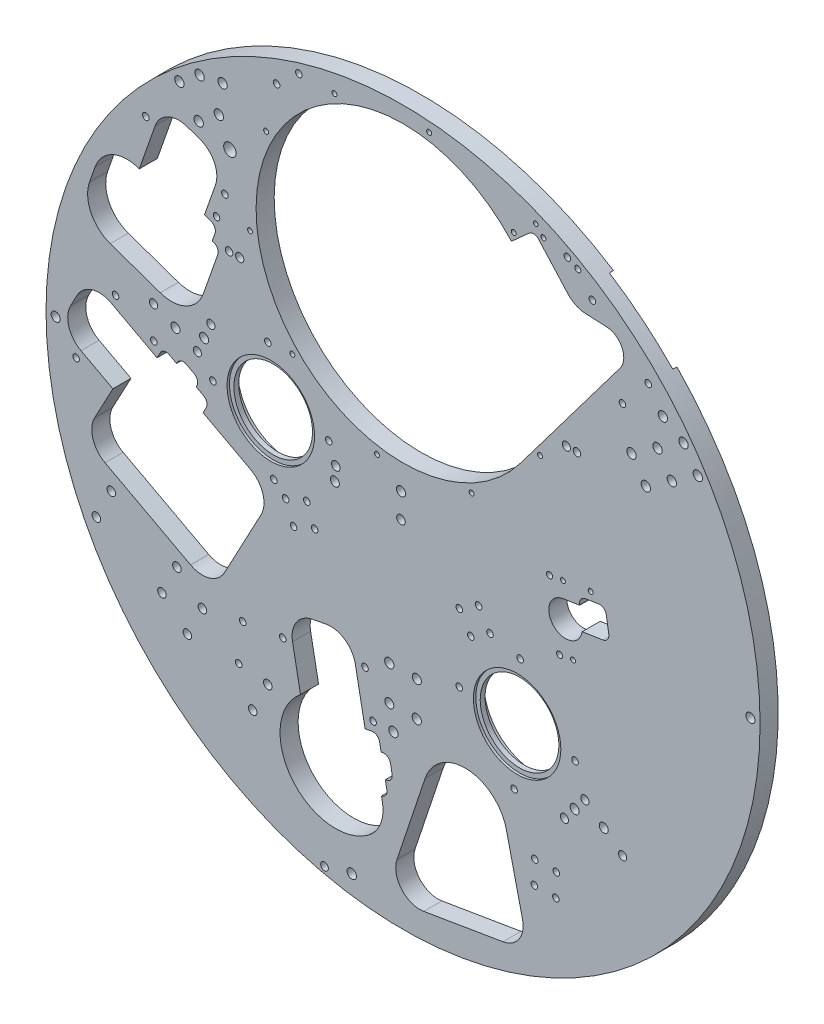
SolidWorks part; units mm, degrees
ref_plane "Front" through (0, 0, 0) normal (0, 0, 1) x (1, 0, 0)
ref_plane "Top" through (0, 0, 0) normal (0, 1, 0) x (1, 0, 0)
ref_plane "Right" through (0, 0, 0) normal (1, 0, 0) x (0, 0, -1)
sketch "Sketch1" plane through (0, 0, 0) normal (0, 0, 1) x (1, 0, 0)
  circle A0 centre (0, 0) radius 187.96
  dimension "D1" = 375.92
extrude ".375 base" add sketch "Sketch1" along normal blind 9.525
sketch "Sketch2" plane through (0, 0, 0) normal (0, 0, -1) x (-1, 0, 0)
  line L0 (0, 102.108) -> (2.8248, 24.7908) construction
  line L1 (-106.6865, 130.8873) -> (-100.7163, 123.4771) construction
  line L2 (-114.2842, 125.1577) -> (-61.7729, 55.5243)
  line L3 (-57.0751, 154.3418) -> (-68.2654, 142.1143)
  line L5 (-107.1075, 140.394) -> (-68.2654, 142.1143)
  arc A0 (-61.7729, 55.5243) -> (-57.0751, 154.3418) centre (0, 102.108) ccw
  arc A3 (-107.1075, 140.394) -> (-114.2842, 125.1577) centre (-106.6865, 130.8873) ccw
  point P3 (2.7877, 25.8061)
  point P13 (-101.3537, 124.2682)
  dimension "D1" = 1.016
  dimension "D3" = 135
  dimension "D4" = 77.3688
  dimension "D5" = 9.516
  dimension "D6" = 102.108
  dimension "D10" = 57.0751
  dimension "D2" = 1.016
  dimension "D7" = 106.6865
  dimension "D8" = 28.7793
  dimension "D9" = 168.8594
  dimension "D11" = 77.3172
  dimension "D12" = 5.3327
extrude "carosel" cut sketch "Sketch2" against normal through all
sketch "Sketch5" plane through (0, 0, 0) normal (0, 0, -1) x (-1, 0, 0)
  circle A0 centre (69.6168, 13.7234) radius 20.701
  circle A2 centre (-60.0464, -64.1854) radius 20.701
  dimension "D1" = 41.402
  dimension "D3" = 69.6168
  dimension "D4" = 13.7234
  dimension "D5" = 60.0464
  dimension "D6" = 64.1854
extrude "heater" cut sketch "Sketch5" against normal through all
sketch "Sketch8" plane through (0, 0, 0) normal (0, 0, -1) x (-1, 0, 0)
  circle A0 centre (69.6168, 13.7234) radius 27.0002
  circle A1 centre (69.6168, 13.7234) radius 20.701 construction
  circle A2 centre (-60.0464, -64.1854) radius 27.0002
  circle A3 centre (-60.0464, -64.1854) radius 20.701 construction
  dimension "D1" = 54.0004
extrude "heater seal" cut sketch "Sketch8" against normal blind 5.715
hole_wizard "#8-32 for heaters" positions "Sketch19" profile "Sketch18" tap size "#8-32" standard "Ansi Inch"
sketch "Sketch19" plane through (0, 0, 9.525) normal (0, 0, 1) x (1, 0, 0)
  line L0 (60.0464, -64.1854) -> (60.0464, -20.8608) construction
  line L2 (60.0464, -64.1854) -> (61.6444, -33.6944) construction
  circle A10 centre (60.0464, -64.1854) radius 27.0002 construction
  point P0 (-100.1078, 12.1254)
  point P1 (-68.0188, -16.7676)
  point P2 (-71.2148, 44.2144)
  point P3 (-39.1258, 15.3214)
  point P10 (29.5554, -62.5874)
  point P11 (58.4485, -94.6764)
  point P14 (90.5374, -65.7834)
  point P15 (61.6444, -33.6944)
  dimension "D1" = 39.1258
  dimension "D2" = 15.3214
  dimension "D3" = 44.2144
  dimension "D4" = 71.2148
  dimension "D5" = 100.1078
  dimension "D6" = 12.1254
  dimension "D7" = 16.7676
  dimension "D8" = 68.0188
  dimension "D9" = 3
  dimension "D10" = 30.5329
  dimension "D11" = 30.491
  dimension "D12" = 1.598
  dimension "D13" = 30.491
  dimension "D14" = 1.598
  dimension "D15" = 30.491
  dimension "D16" = 1.598
sketch "Sketch18" plane through (-100.1078, 12.1254, 9.525) normal (1, 0, 0) x (0, -1, 0)
  line L0 (0, 0) -> (0, 9.525)
  line L1 (0, 9.525) -> (1.7272, 9.525)
  line L2 (1.7272, 9.525) -> (1.7272, 0)
  line L5 (1.7272, 0) -> (0, 0)
  line L11 (0, -6.35) -> (0, 107.95) construction
  dimension "Thru Tap Drill Dia." = 3.4544
  dimension "Thru Tap Drill Depth" = 9.525
sketch "Sketch9" plane through (0, 0, 9.525) normal (0, 0, 1) x (1, 0, 0)
  circle A0 centre (-69.6168, 13.7234) radius 23.0251
  circle A1 centre (-69.6168, 13.7234) radius 20.701 construction
  circle A2 centre (60.0464, -64.1854) radius 23.0251
  circle A3 centre (60.0464, -64.1854) radius 20.701 construction
  dimension "D1" = 46.0502
extrude "Sample heater bore" cut sketch "Sketch9" against normal blind 1.27
hole_wizard "3/16 for clamps" positions "Sketch15" profile "Sketch14" hole size "3/16" standard "Ansi Inch"
sketch "Sketch15" plane through (0, 0, 9.525) normal (0, 0, 1) x (1, 0, 0)
  point P0 (-104.7245, 29.3544)
  point P1 (-119.8109, 26.5067)
  point P6 (90.3338, -87.8485)
  point P7 (105.6609, -88.7352)
  dimension "D1" = 104.7245
  dimension "D2" = 29.3544
  dimension "D3" = 26.5067
  dimension "D4" = 119.8109
  dimension "D5" = 90.3338
  dimension "D6" = 105.6609
  dimension "D7" = 88.7352
  dimension "D8" = 87.8485
sketch "Sketch14" plane through (-104.7245, 29.3544, 9.525) normal (1, 0, 0) x (0, -1, 0)
  line L0 (0, 0) -> (0, 9.525)
  line L1 (0, 9.525) -> (2.3749, 9.525)
  line L2 (2.3749, 9.525) -> (2.3749, 0)
  line L5 (2.3749, 0) -> (0, 0)
  line L11 (0, -6.35) -> (0, 107.95) construction
  dimension "Thru Hole Dia." = 4.7498
  dimension "Thru Hole Depth" = 9.525
hole_wizard "#18 for clamps" positions "Sketch17" profile "Sketch16" hole size "#18" standard "Ansi Inch"
sketch "Sketch17" plane through (0, 0, 9.525) normal (0, 0, 1) x (1, 0, 0)
  point P0 (-101.1706, 37.3366)
  point P1 (-131.3433, 31.6413)
  point P2 (-108.2784, 21.3722)
  point P9 (84.9544, -94.7338)
  point P10 (95.7132, -80.9632)
  point P11 (115.6086, -96.5072)
  dimension "D1" = 101.1706
  dimension "D2" = 108.2784
  dimension "D3" = 131.3433
  dimension "D4" = 37.3366
  dimension "D5" = 21.3722
  dimension "D6" = 31.6413
  dimension "D7" = 84.9544
  dimension "D8" = 95.7132
  dimension "D9" = 115.6086
  dimension "D10" = 80.9632
  dimension "D11" = 94.7338
  dimension "D12" = 96.5072
sketch "Sketch16" plane through (-101.1706, 37.3366, 9.525) normal (1, 0, 0) x (0, -1, 0)
  line L0 (0, 0) -> (0, 9.525)
  line L1 (0, 9.525) -> (2.1526, 9.525)
  line L2 (2.1526, 9.525) -> (2.1526, 0)
  line L5 (2.1526, 0) -> (0, 0)
  line L11 (0, -6.35) -> (0, 107.95) construction
  dimension "Thru Hole Dia." = 4.3053
  dimension "Thru Hole Depth" = 9.525
sketch "Sketch20" plane through (0, 0, 0) normal (0, 0, -1) x (-1, 0, 0)
  circle A0 centre (182.88, 0) radius 2.3749
  circle A2 centre (-182.88, 0) radius 2.3749
  dimension "D1" = 4.7498
  dimension "D5" = 4.7498
  dimension "D4" = 182.88
  dimension "D6" = 182.88
extrude "locating pins - fabrication" cut sketch "Sketch20" against normal through all
sketch "Sketch29" plane through (0, 0, 0) normal (0, 0, -1) x (-1, 0, 0)
  line L0 (-75.6506, 127.7436) -> (-54.1018, 151.676)
  line L1 (-54.1018, 151.676) -> (-68.9675, 165.0611)
  line L2 (-68.9675, 165.0611) -> (-90.5163, 141.1288)
  line L3 (-75.6506, 127.7436) -> (-90.5163, 141.1288)
  line L5 (0, 0) -> (0, 172.265) construction
  line L6 (-68.2654, 142.1143) -> (-107.1075, 140.394) construction
  dimension "D1" = 32.2042
  dimension "D2" = 151.676
  dimension "D3" = 20.0038
  dimension "D4" = 54.1018
extrude "carousel hall sensor" cut sketch "Sketch29" against normal through all
fillet "Fillet3" radius 3.556 1 edges at (68.9675, 165.0611, 4.7625)
hole_wizard "#5-40 Tapped Hole1" positions "Sketch31" profile "Sketch30" tap size "#5-40" standard "Ansi Inch"
sketch "Sketch31" plane through (0, 0, 0) normal (0, 0, -1) x (-1, 0, 0)
  point P0 (-73.8764, 164.3542)
  dimension "D1" = 164.3542
  dimension "D2" = 73.8764
sketch "Sketch30" plane through (73.8764, 164.3542, 0) normal (1, 0, 0) x (0, 1, 0)
  line L0 (0, 0) -> (0, 9.525)
  line L1 (0, 9.525) -> (1.289, 9.525)
  line L2 (1.289, 9.525) -> (1.289, 0)
  line L5 (1.289, 0) -> (0, 0)
  line L11 (0, -6.35) -> (0, 107.95) construction
  dimension "Thru Tap Drill Dia." = 2.5781
  dimension "Thru Tap Drill Depth" = 9.525
hole_wizard "3/32 (0.093750) Diameter Hole1" positions "Sketch33" profile "Sketch32" hole size "3/32" standard "Ansi Inch"
sketch "Sketch33" plane through (0, 0, 0) normal (0, 0, -1) x (-1, 0, 0)
  point P0 (-69.8824, 168.7901)
  dimension "D1" = 69.8824
  dimension "D2" = 168.7901
sketch "Sketch32" plane through (69.8824, 168.7901, 0) normal (1, 0, 0) x (0, 1, 0)
  line L0 (0, 0) -> (0, 9.525)
  line L1 (0, 9.525) -> (1.1913, 9.525)
  line L2 (1.1913, 9.525) -> (1.1913, 0)
  line L5 (1.1913, 0) -> (0, 0)
  line L11 (0, -6.35) -> (0, 107.95) construction
  dimension "Thru Hole Dia." = 2.3825
  dimension "Thru Hole Depth" = 9.525
hole_wizard "#5-40 Tapped Hole2" positions "Sketch39" profile "Sketch38" tap size "#5-40" standard "Ansi Inch"
sketch "Sketch39" plane through (0, 0, 9.525) normal (0, 0, 1) x (1, 0, 0)
  point P0 (36.0788, 29.108)
  point P3 (58.2781, 158.9793)
  point P4 (13.7199, 182.3728)
  point P5 (-36.0788, 175.108)
  point P8 (-13.7199, 21.8432)
  point P9 (-72.0967, 139.9596)
  point P10 (-80.5761, 90.3532)
  point P11 (-58.2781, 45.2367)
  point P12 (72.0967, 64.2564)
  dimension "D1" = 13.7199
  dimension "D2" = 58.2781
  dimension "D3" = 36.0788
  dimension "D4" = 72.0967
  dimension "D5" = 80.5761
  dimension "D6" = 72.0967
  dimension "D7" = 36.0788
  dimension "D8" = 13.7199
  dimension "D9" = 58.2781
  dimension "D10" = 158.9793
  dimension "D11" = 182.3728
  dimension "D12" = 64.2564
  dimension "D13" = 29.108
  dimension "D14" = 21.8432
  dimension "D15" = 45.2367
  dimension "D16" = 90.3532
  dimension "D17" = 139.9596
  dimension "D18" = 175.108
sketch "Sketch38" plane through (36.0788, 29.108, 9.525) normal (1, 0, 0) x (0, -1, 0)
  line L0 (0, 0) -> (0, 9.525)
  line L1 (0, 9.525) -> (1.289, 9.525)
  line L2 (1.289, 9.525) -> (1.289, 0)
  line L5 (1.289, 0) -> (0, 0)
  line L11 (0, -6.35) -> (0, 107.95) construction
  dimension "Thru Tap Drill Dia." = 2.5781
  dimension "Thru Tap Drill Depth" = 9.525
fillet "Fillet6" radius 13.208 1 edges at (90.5163, 141.1288, 4.7625)
sketch "Sketch41" plane through (0, 0, 0) normal (0, 0, -1) x (-1, 0, 0)
  line L0 (-106.6865, 130.8873) -> (-109.7316, 103.0754) construction
  circle A0 centre (-106.6865, 130.8873) radius 27.9781
  point P4 (-109.7274, 103.1133)
  dimension "D2" = 55.9562
  dimension "D5" = 130.8873
  dimension "D1" = 0.0381
  dimension "D3" = 106.6865
  dimension "D4" = 27.8119
extrude "carousel drive" cut sketch "Sketch41" against normal blind 2.159
hole_wizard "#8-32 Tapped Hole2" positions "Sketch43" profile "Sketch42" tap size "#8-32" standard "Ansi Inch"
sketch "Sketch43" plane through (0, 0, 2.159) normal (0, 0, -1) x (-1, 0, 0)
  point P0 (-99.6461, 148.7604)
  point P9 (-129.0854, 125.5098)
  point P10 (-115.5017, 109.6054)
  dimension "D1" = 148.7604
  dimension "D2" = 125.5098
  dimension "D3" = 109.6054
  dimension "D4" = 115.5017
  dimension "D5" = 129.0854
  dimension "D6" = 99.6461
sketch "Sketch42" plane through (99.6461, 148.7604, 2.159) normal (1, 0, 0) x (0, 1, 0)
  line L0 (0, 0) -> (0, 7.366)
  line L1 (0, 7.366) -> (1.7272, 7.366)
  line L2 (1.7272, 7.366) -> (1.7272, 0)
  line L5 (1.7272, 0) -> (0, 0)
  line L11 (0, -6.35) -> (0, 107.95) construction
  dimension "Thru Tap Drill Dia." = 3.4544
  dimension "Thru Tap Drill Depth" = 7.366
hole_wizard "1/8 (0.125000) Diameter Hole1" positions "Sketch45" profile "Sketch44" hole size "1/8" standard "Ansi Inch"
sketch "Sketch45" plane through (0, 0, 0) normal (0, 0, -1) x (-1, 0, 0)
  point P0 (-91.9924, 159.1779)
  dimension "D1" = 91.9924
  dimension "D2" = 159.1779
sketch "Sketch44" plane through (91.9924, 159.1779, 0) normal (1, 0, 0) x (0, 1, 0)
  line L0 (0, 0) -> (0, 9.525)
  line L1 (0, 9.525) -> (1.5837, 9.525)
  line L2 (1.5837, 9.525) -> (1.5837, 0)
  line L5 (1.5837, 0) -> (0, 0)
  line L11 (0, -6.35) -> (0, 107.95) construction
  dimension "Thru Hole Dia." = 3.1674
  dimension "Thru Hole Depth" = 9.525
hole_wizard "#8-32 Tapped Hole3" positions "Sketch47" profile "Sketch46" tap size "#8-32" standard "Ansi Inch"
sketch "Sketch47" plane through (0, 0, 0) normal (0, 0, -1) x (-1, 0, 0)
  point P0 (-86.4987, 161.8352)
  dimension "D1" = 86.4987
  dimension "D2" = 161.8352
sketch "Sketch46" plane through (86.4987, 161.8352, 0) normal (1, 0, 0) x (0, 1, 0)
  line L0 (0, 0) -> (0, 9.525)
  line L1 (0, 9.525) -> (1.7272, 9.525)
  line L2 (1.7272, 9.525) -> (1.7272, 0)
  line L5 (1.7272, 0) -> (0, 0)
  line L11 (0, -6.35) -> (0, 107.95) construction
  dimension "Thru Tap Drill Dia." = 3.4544
  dimension "Thru Tap Drill Depth" = 9.525
hole_wizard "collection rotary valve - TOP" positions "Sketch49" profile "Sketch48" tap size "#8-32" standard "Ansi Inch"
sketch "Sketch49" plane through (0, 0, 9.525) normal (0, 0, 1) x (1, 0, 0)
  point P0 (-86.5559, -109.9422)
  point P1 (-84.4318, -89.7335)
  dimension "D1" = 84.4318
  dimension "D2" = 86.5559
  dimension "D3" = 109.9422
  dimension "D4" = 89.7335
sketch "Sketch48" plane through (-86.5559, -109.9422, 9.525) normal (1, 0, 0) x (0, -1, 0)
  line L0 (0, 0) -> (0, 9.525)
  line L1 (0, 9.525) -> (1.7272, 9.525)
  line L2 (1.7272, 9.525) -> (1.7272, 0)
  line L5 (1.7272, 0) -> (0, 0)
  line L11 (0, -6.35) -> (0, 107.95) construction
  dimension "Thru Tap Drill Dia." = 3.4544
  dimension "Thru Tap Drill Depth" = 9.525
sketch "Sketch50" plane through (0, 0, 0) normal (0, 0, -1) x (-1, 0, 0)
  line L0 (106.8708, 118.8518) -> (113.7025, 121.2459)
  line L2 (130.5354, 113.1494) -> (138.8718, 89.3618)
  line L3 (98.7743, 102.0188) -> (104.5287, 85.5989)
  line L4 (104.5287, 85.5989) -> (101.1728, 84.4228)
  line L5 (98.993, 79.8909) -> (100.421, 75.8159)
  line L6 (100.421, 75.8159) -> (99.7019, 75.5639)
  line L7 (97.5221, 71.0319) -> (105.1245, 49.3385)
  line L8 (0, 0) -> (0, 132.8162) construction
  line L9 (165.0511, 70.3397) -> (162.1309, 78.6727)
  line L10 (139.4711, 89.5718) -> (138.8718, 89.3618)
  line L24 (127.7843, 38.4393) -> (154.152, 47.6799)
  arc A0 (154.152, 47.6799) -> (165.0511, 70.3397) centre (148.2717, 64.4593) ccw
  arc A1 (127.7843, 38.4393) -> (105.1245, 49.3385) centre (121.904, 55.2188) cw
  arc A2 (130.5354, 113.1494) -> (113.7025, 121.2459) centre (118.0707, 108.7812) ccw
  arc A3 (106.8708, 118.8518) -> (98.7743, 102.0188) centre (111.2391, 106.387) ccw
  arc A4 (98.993, 79.8909) -> (101.1728, 84.4228) centre (102.3488, 81.0669) cw
  arc A5 (162.1309, 78.6727) -> (139.4711, 89.5718) centre (145.3514, 72.7923) ccw
  arc A6 (97.5221, 71.0319) -> (99.7019, 75.5639) centre (100.878, 72.208) cw
  circle A10 centre (0, 0) radius 187.96 construction
  dimension "D2" = 13.208
  dimension "D3" = 3.556
  dimension "D12" = 13.208
  dimension "D14" = 82.804
  dimension "D15" = 7.874
  dimension "D13" = 30.607
  dimension "D9" = 17.78
  dimension "D11" = 3.556
  dimension "D7" = 7.62
  dimension "D6" = 33.655
  dimension "D4" = 121.904
  dimension "D5" = 55.2188
  dimension "D8" = 7.112
  dimension "D10" = 11.43
  dimension "D16" = 63.5
  dimension "D17" = 19.313
extrude "Internal Sampler" cut sketch "Sketch50" against normal through all
hole_wizard "#8-32 Tapped Hole (Syringes)" positions "Sketch52" profile "Sketch51" tap size "#8-32" standard "Ansi Inch"
sketch "Sketch52" plane through (0, 0, 0) normal (0, 0, -1) x (-1, 0, 0)
  point P0 (151.3542, 25.516)
  point P1 (131.1888, 14.7486)
  point P2 (63.3203, -86.6623)
  point P3 (93.8184, 100.4166)
  point P4 (135.4074, 114.9914)
  point P5 (15.7468, -100.8545)
  point P6 (20.0328, -78.3999)
  point P7 (172.1113, -13.3585)
  point P19 (98.1866, 87.9518)
  dimension "D1" = 114.9914
  dimension "D2" = 100.4166
  dimension "D3" = 87.9518
  dimension "D4" = 25.516
  dimension "D5" = 14.7486
  dimension "D6" = 13.3585
  dimension "D7" = 172.1113
  dimension "D8" = 131.1888
  dimension "D9" = 151.3542
  dimension "D10" = 98.1866
  dimension "D11" = 93.8184
  dimension "D12" = 135.4074
  dimension "D13" = 78.3999
  dimension "D14" = 100.8545
  dimension "D15" = 86.6623
  dimension "D16" = 20.0328
  dimension "D17" = 15.7468
  dimension "D18" = 63.3203
sketch "Sketch51" plane through (-151.3542, 25.516, 0) normal (1, 0, 0) x (0, 1, 0)
  line L0 (0, 0) -> (0, 9.525)
  line L1 (0, 9.525) -> (1.7272, 9.525)
  line L2 (1.7272, 9.525) -> (1.7272, 0)
  line L5 (1.7272, 0) -> (0, 0)
  line L11 (0, -6.35) -> (0, 107.95) construction
  dimension "Thru Tap Drill Dia." = 3.4544
  dimension "Thru Tap Drill Depth" = 9.525
hole_wizard "#5 C'bore valve mounting" positions "Sketch54" profile "Sketch53" counterbore size "#5" standard "Ansi Inch"
sketch "Sketch54" plane through (0, 0, 0) normal (0, 0, -1) x (-1, 0, 0)
  point P0 (61.7947, -22.4206)
  point P1 (50.6874, -18.0453)
  point P6 (57.6358, -32.9787)
  point P9 (46.5284, -28.6034)
  point P12 (-35.6446, -36.3983)
  point P13 (-29.6312, -26.7749)
  point P14 (-39.7552, -20.4487)
  point P15 (-45.7686, -30.0721)
  point P24 (-80.6667, -121.4168)
  point P25 (-69.3207, -121.2188)
  point P26 (-80.4584, -133.353)
  point P27 (-69.1124, -133.155)
  dimension "D1" = 29.6312
  dimension "D2" = 39.7552
  dimension "D3" = 35.6446
  dimension "D4" = 45.7686
  dimension "D5" = 26.7749
  dimension "D6" = 20.4487
  dimension "D7" = 30.0721
  dimension "D8" = 36.3983
  dimension "D9" = 18.0453
  dimension "D10" = 22.4206
  dimension "D11" = 28.6034
  dimension "D12" = 32.9787
  dimension "D13" = 50.6874
  dimension "D14" = 61.7947
  dimension "D15" = 46.5284
  dimension "D16" = 57.6358
  dimension "D17" = 121.2188
  dimension "D18" = 121.4168
  dimension "D19" = 133.353
  dimension "D20" = 133.155
  dimension "D21" = 69.3207
  dimension "D22" = 69.1124
  dimension "D23" = 80.4584
  dimension "D24" = 80.6667
sketch "Sketch53" plane through (-61.7947, -22.4206, 0) normal (1, 0, 0) x (0, 1, 0)
  line L0 (0, 0) -> (0, 9.525)
  line L1 (0, 9.525) -> (1.7272, 9.525)
  line L3 (1.7272, 9.525) -> (1.7272, 5.08)
  line L4 (1.7272, 5.08) -> (3.175, 5.08)
  line L5 (3.175, 5.08) -> (3.175, 0)
  line L7 (3.175, 0) -> (0, 0)
  line L11 (0, -6.35) -> (0, 107.95) construction
  dimension "Thru Hole Dia." = 3.4544
  dimension "Thru Hole Depth" = 9.525
  dimension "C'Bore Dia." = 6.35
  dimension "C'Bore Depth" = 5.08
hole_wizard "3/16 (0.187500) Diameter Hole2" positions "Sketch56" profile "Sketch55" hole size "3/16" standard "Ansi Inch"
sketch "Sketch56" plane through (0, 0, 9.525) normal (0, 0, 1) x (1, 0, 0)
  point P0 (-7.239, -88.392)
  point P1 (7.239, -70.104)
  dimension "D1" = 70.104
  dimension "D2" = 88.392
  dimension "D3" = 7.239
  dimension "D4" = 7.239
sketch "Sketch55" plane through (-7.239, -88.392, 9.525) normal (1, 0, 0) x (0, -1, 0)
  line L0 (0, 0) -> (0, 9.525)
  line L1 (0, 9.525) -> (2.3749, 9.525)
  line L2 (2.3749, 9.525) -> (2.3749, 0)
  line L5 (2.3749, 0) -> (0, 0)
  line L11 (0, -6.35) -> (0, 107.95) construction
  dimension "Thru Hole Dia." = 4.7498
  dimension "Thru Hole Depth" = 9.525
hole_wizard "#10 (0.193500) Diameter Hole2" positions "Sketch58" profile "Sketch57" hole size "#10" standard "Ansi Inch"
sketch "Sketch58" plane through (0, 0, 9.525) normal (0, 0, 1) x (1, 0, 0)
  point P0 (7.239, -88.392)
  point P1 (-7.239, -70.104)
  dimension "D1" = 7.239
  dimension "D2" = 7.239
  dimension "D3" = 70.104
  dimension "D4" = 88.392
sketch "Sketch57" plane through (7.239, -88.392, 9.525) normal (1, 0, 0) x (0, -1, 0)
  line L0 (0, 0) -> (0, 9.525)
  line L1 (0, 9.525) -> (2.4574, 9.525)
  line L2 (2.4574, 9.525) -> (2.4574, 0)
  line L5 (2.4574, 0) -> (0, 0)
  line L11 (0, -6.35) -> (0, 107.95) construction
  dimension "Thru Hole Dia." = 4.9149
  dimension "Thru Hole Depth" = 9.525
hole_wizard "CBORE for #8 Socket Head Cap Screw1" positions "Sketch60" profile "Sketch59" counterbore size "#8" standard "Ansi Inch"
sketch "Sketch60" plane through (0, 0, 0) normal (0, 0, -1) x (-1, 0, 0)
  point P0 (35.3733, 5.7574)
  point P1 (1.0833, -1.634)
  dimension "D1" = 1.0833
  dimension "D2" = 35.3733
  dimension "D3" = 5.7574
  dimension "D4" = 1.634
sketch "Sketch59" plane through (-35.3733, 5.7574, 0) normal (1, 0, 0) x (0, 1, 0)
  line L0 (0, 0) -> (0, 9.525)
  line L1 (0, 9.525) -> (2.2606, 9.525)
  line L3 (2.2606, 9.525) -> (2.2606, 5.08)
  line L4 (2.2606, 5.08) -> (3.683, 5.08)
  line L5 (3.683, 5.08) -> (3.683, 0)
  line L7 (3.683, 0) -> (0, 0)
  line L11 (0, -6.35) -> (0, 107.95) construction
  dimension "Thru Hole Dia." = 4.5212
  dimension "Thru Hole Depth" = 9.525
  dimension "C'Bore Dia." = 7.366
  dimension "C'Bore Depth" = 5.08
hole_wizard "3/16 (0.187500) Diameter Hole3" positions "Sketch62" profile "Sketch61" hole size "3/16" standard "Ansi Inch"
sketch "Sketch62" plane through (0, 0, 0) normal (0, 0, -1) x (-1, 0, 0)
  point P0 (1.0833, 11.32)
  point P1 (35.894, -1.634)
  dimension "D1" = 11.32
  dimension "D2" = 1.634
  dimension "D3" = 35.894
  dimension "D4" = 1.0833
sketch "Sketch61" plane through (-1.0833, 11.32, 0) normal (1, 0, 0) x (0, 1, 0)
  line L0 (0, 0) -> (0, 9.525)
  line L1 (0, 9.525) -> (2.3749, 9.525)
  line L2 (2.3749, 9.525) -> (2.3749, 0)
  line L5 (2.3749, 0) -> (0, 0)
  line L11 (0, -6.35) -> (0, 107.95) construction
  dimension "Thru Hole Dia." = 4.7498
  dimension "Thru Hole Depth" = 9.525
hole_wizard "#8-32 Tapped Hole5" positions "Sketch64" profile "Sketch63" tap size "#8-32" standard "Ansi Inch"
sketch "Sketch64" plane through (0, 0, 0) normal (0, 0, -1) x (-1, 0, 0)
  point P0 (66.5694, 164.2733)
  point P1 (54.8664, 174.8108)
  dimension "D1" = 174.8108
  dimension "D2" = 164.2733
  dimension "D3" = 66.5694
  dimension "D4" = 54.8664
sketch "Sketch63" plane through (-66.5694, 164.2733, 0) normal (1, 0, 0) x (0, 1, 0)
  line L0 (0, 0) -> (0, 9.525)
  line L1 (0, 9.525) -> (1.7272, 9.525)
  line L2 (1.7272, 9.525) -> (1.7272, 0)
  line L5 (1.7272, 0) -> (0, 0)
  line L11 (0, -6.35) -> (0, 107.95) construction
  dimension "Thru Tap Drill Dia." = 3.4544
  dimension "Thru Tap Drill Depth" = 9.525
hole_wizard "#18 (0.169500) Diameter Hole4" positions "Sketch66" profile "Sketch65" hole size "#18" standard "Ansi Inch"
sketch "Sketch66" plane through (0, 0, 0) normal (0, 0, -1) x (-1, 0, 0)
  point P0 (85.979, 75.438)
  point P1 (-85.979, 75.438)
  dimension "D1" = 85.979
  dimension "D2" = 85.979
  dimension "D3" = 75.438
  dimension "D4" = 75.438
sketch "Sketch65" plane through (-85.979, 75.438, 0) normal (1, 0, 0) x (0, 1, 0)
  line L0 (0, 0) -> (0, 9.525)
  line L1 (0, 9.525) -> (2.1526, 9.525)
  line L2 (2.1526, 9.525) -> (2.1526, 0)
  line L5 (2.1526, 0) -> (0, 0)
  line L11 (0, -6.35) -> (0, 107.95) construction
  dimension "Thru Hole Dia." = 4.3053
  dimension "Thru Hole Depth" = 9.525
hole_wizard "5/32 (0.156250) Diameter Hole1" positions "Sketch68" profile "Sketch67" hole size "5/32" standard "Ansi Inch"
sketch "Sketch68" plane through (0, 0, 0) normal (0, 0, -1) x (-1, 0, 0)
  point P0 (-91.567, 75.438)
  point P1 (91.567, 75.438)
  dimension "D1" = 91.567
  dimension "D2" = 91.567
  dimension "D3" = 75.438
  dimension "D4" = 75.438
sketch "Sketch67" plane through (91.567, 75.438, 0) normal (1, 0, 0) x (0, 1, 0)
  line L0 (0, 0) -> (0, 9.525)
  line L1 (0, 9.525) -> (1.9812, 9.525)
  line L2 (1.9812, 9.525) -> (1.9812, 0)
  line L5 (1.9812, 0) -> (0, 0)
  line L11 (0, -6.35) -> (0, 107.95) construction
  dimension "Thru Hole Dia." = 3.9624
  dimension "Thru Hole Depth" = 9.525
hole_wizard "#10 (0.1935) Diameter Hole1" positions "Sketch70" profile "Sketch69" hole size "#10" standard "Ansi Inch"
sketch "Sketch70" plane through (0, 0, 0) normal (0, 0, -1) x (-1, 0, 0)
  point P0 (-136.7718, 114.3708)
  point P1 (94.994, 150.3643)
  dimension "D1" = 136.7718
  dimension "D2" = 114.3708
  dimension "D3" = 150.3643
  dimension "D4" = 94.994
sketch "Sketch69" plane through (136.7718, 114.3708, 0) normal (1, 0, 0) x (0, 1, 0)
  line L0 (0, 0) -> (0, 9.525)
  line L1 (0, 9.525) -> (2.4574, 9.525)
  line L2 (2.4574, 9.525) -> (2.4574, 0)
  line L5 (2.4574, 0) -> (0, 0)
  line L11 (0, -6.35) -> (0, 107.95) construction
  dimension "Thru Hole Dia." = 4.9149
  dimension "Thru Hole Depth" = 9.525
hole_wizard "CBORE for #8 Socket Head Cap Screw2" positions "Sketch72" profile "Sketch71" counterbore size "#8" standard "Ansi Inch"
sketch "Sketch72" plane through (0, 0, 0) normal (0, 0, -1) x (-1, 0, 0)
  point P0 (79.1247, -127.4885)
  point P1 (71.2052, -111.8539)
  point P2 (105.6466, -94.4078)
  point P3 (113.5662, -110.0424)
  point P4 (119.0719, -82.2125)
  point P5 (126.9198, -97.8832)
  point P6 (161.4408, -80.595)
  point P7 (153.5929, -64.9243)
  dimension "D1" = 71.2052
  dimension "D2" = 79.1247
  dimension "D3" = 105.6466
  dimension "D4" = 113.5662
  dimension "D5" = 119.0719
  dimension "D6" = 126.9198
  dimension "D7" = 161.4408
  dimension "D8" = 153.5929
  dimension "D9" = 64.9243
  dimension "D10" = 80.595
  dimension "D11" = 82.2125
  dimension "D12" = 97.8832
  dimension "D13" = 94.4078
  dimension "D14" = 110.0424
  dimension "D15" = 111.8539
  dimension "D16" = 127.4885
sketch "Sketch71" plane through (-79.1247, -127.4885, 0) normal (1, 0, 0) x (0, 1, 0)
  line L0 (0, 0) -> (0, 9.525)
  line L1 (0, 9.525) -> (2.2479, 9.525)
  line L3 (2.2479, 9.525) -> (2.2479, 5.842)
  line L4 (2.2479, 5.842) -> (3.9687, 5.842)
  line L5 (3.9687, 5.842) -> (3.9687, 0)
  line L7 (3.9687, 0) -> (0, 0)
  line L11 (0, -6.35) -> (0, 107.95) construction
  dimension "Thru Hole Dia." = 4.4958
  dimension "Thru Hole Depth" = 9.525
  dimension "C'Bore Dia." = 7.9375
  dimension "C'Bore Depth" = 5.842
hole_wizard "#10 (0.1935) Diameter Hole2" positions "Sketch74" profile "Sketch73" hole size "#10" standard "Ansi Inch"
sketch "Sketch74" plane through (0, 0, 0) normal (0, 0, -1) x (-1, 0, 0)
  point P0 (5.0678, -100.3389)
  dimension "D1" = 100.3389
  dimension "D2" = 5.0678
sketch "Sketch73" plane through (-5.0678, -100.3389, 0) normal (1, 0, 0) x (0, 1, 0)
  line L0 (0, 0) -> (0, 9.525)
  line L1 (0, 9.525) -> (2.4574, 9.525)
  line L2 (2.4574, 9.525) -> (2.4574, 0)
  line L5 (2.4574, 0) -> (0, 0)
  line L11 (0, -6.35) -> (0, 107.95) construction
  dimension "Thru Hole Dia." = 4.9149
  dimension "Thru Hole Depth" = 9.525
sketch "Sketch77" plane through (0, 0, 0) normal (0, 0, -1) x (-1, 0, 0)
  line L0 (-93.0087, 6.3956) -> (-92.9491, 6.772)
  line L1 (-93.0087, 6.3956) -> (-84.1669, 4.9952)
  line L3 (-105.344, -3.2917) -> (-94.2745, -5.0449)
  line L4 (-95.905, 10.8405) -> (-102.9294, 11.953)
  line L6 (-108.2999, 0.7768) -> (-106.9979, 8.9971)
  line L9 (0, 0) -> (-64.3755, 0) construction
  arc A0 (-94.2745, -5.0449) -> (-84.1669, 4.9952) centre (-85.5476, -3.7226) ccw
  arc A2 (-102.9294, 11.953) -> (-106.9979, 8.9971) centre (-103.4857, 8.4408) ccw
  arc A3 (-105.344, -3.2917) -> (-108.2999, 0.7768) centre (-104.7877, 0.2206) cw
  arc A4 (-92.9491, 6.772) -> (-95.905, 10.8405) centre (-96.4613, 7.3282) ccw
  dimension "D1" = 9
  dimension "D3" = 3.556
  dimension "D4" = 3.556
  dimension "D9" = 8.8265
  dimension "D6" = 23.176
  dimension "D2" = 85.5476
  dimension "D5" = 0.381
  dimension "D7" = 7.112
  dimension "D8" = 3.7226
  dimension "D10" = 11.4977
  dimension "D11" = 64.3755
extrude "flush puck holder" cut sketch "Sketch77" against normal through all
hole_wizard "#5-40 Tapped Hole3" positions "Sketch79" profile "Sketch78" tap size "#5-40" standard "Ansi Inch"
sketch "Sketch79" plane through (0, 0, 0) normal (0, 0, -1) x (-1, 0, 0)
  point P0 (-89.4642, -20.3324)
  point P1 (-84.1398, 13.2846)
  point P2 (-98.7517, 15.5989)
  dimension "D1" = 84.1398
  dimension "D2" = 98.7517
  dimension "D3" = 89.4642
  dimension "D4" = 20.3324
  dimension "D5" = 13.2846
  dimension "D6" = 15.5989
sketch "Sketch78" plane through (89.4642, -20.3324, 0) normal (1, 0, 0) x (0, 1, 0)
  line L0 (0, 0) -> (0, 9.525)
  line L1 (0, 9.525) -> (1.289, 9.525)
  line L2 (1.289, 9.525) -> (1.289, 0)
  line L5 (1.289, 0) -> (0, 0)
  line L11 (0, -6.35) -> (0, 107.95) construction
  dimension "Thru Tap Drill Dia." = 2.5781
  dimension "Thru Tap Drill Depth" = 9.525
hole_wizard "1/8 (0.125) Diameter Hole1" positions "Sketch81" profile "Sketch80" hole size "1/8" standard "Ansi Inch"
sketch "Sketch81" plane through (0, 0, 0) normal (0, 0, -1) x (-1, 0, 0)
  point P0 (-82.4398, -21.445)
  point P1 (-77.1154, 12.172)
  dimension "D1" = 77.1154
  dimension "D2" = 82.4398
  dimension "D3" = 21.445
  dimension "D4" = 12.172
sketch "Sketch80" plane through (82.4398, -21.445, 0) normal (1, 0, 0) x (0, 1, 0)
  line L0 (0, 0) -> (0, 9.525)
  line L1 (0, 9.525) -> (1.5837, 9.525)
  line L2 (1.5837, 9.525) -> (1.5837, 0)
  line L5 (1.5837, 0) -> (0, 0)
  line L11 (0, -6.35) -> (0, 107.95) construction
  dimension "Thru Hole Dia." = 3.1674
  dimension "Thru Hole Depth" = 9.525
sketch "Sketch87" plane through (0, 0, 0) normal (0, 0, -1) x (-1, 0, 0)
  line L0 (19.9805, -106.4464) -> (25.1236, -79.5009)
  line L1 (40.5738, -69.0034) -> (47.6844, -70.3607)
  line L2 (58.1818, -85.8108) -> (53.98, -107.8249)
  line L3 (19.9805, -106.4464) -> (16.4876, -105.7797)
  line L4 (6.6102, -115.5308) -> (5.753, -120.0217)
  line L6 (10.7699, -112.7045) -> (11.5183, -112.8474)
  line L7 (11.5183, -112.8474) -> (12.3279, -108.606)
  line L8 (8.5793, -124.1813) -> (9.3277, -124.3242)
  line L9 (9.3277, -124.3242) -> (8.5182, -128.5656)
  line L11 (11.3444, -132.7253) -> (10.8682, -135.2202)
  line L14 (0, 0) -> (0, -202.9001) construction
  arc A0 (18.2373, -154.0139) -> (53.98, -107.8249) centre (35.56, -130.4948) ccw
  arc A1 (40.5738, -69.0034) -> (25.1236, -79.5009) centre (38.0974, -81.9772) ccw
  arc A2 (8.5182, -128.5656) -> (11.3444, -132.7253) centre (12.0111, -129.2323) ccw
  arc A3 (16.4876, -105.7797) -> (12.3279, -108.606) centre (15.8209, -109.2727) ccw
  arc A4 (5.753, -120.0217) -> (8.5793, -124.1813) centre (9.246, -120.6884) ccw
  arc A5 (10.7699, -112.7045) -> (6.6102, -115.5308) centre (10.1031, -116.1975) ccw
  arc A6 (58.1818, -85.8108) -> (47.6844, -70.3607) centre (45.2081, -83.3344) ccw
  arc A7 (18.2373, -154.0139) -> (10.8682, -135.2202) centre (29.4651, -138.7699) cw
  point P26 (6.1816, -117.7762)
  dimension "D1" = 3.556
  dimension "D2" = 13.208
  dimension "D5" = 29.21
  dimension "D9" = 7.874
  dimension "D7" = 130.4948
  dimension "D3" = 27.432
  dimension "D4" = 33.655
  dimension "D6" = 11.43
  dimension "D8" = 40.64
  dimension "D10" = 10.806
  dimension "D11" = 35.56
  dimension "D12" = 7.112
  dimension "D13" = 11.684
  dimension "D14" = 38.0974
  dimension "D15" = 69.0034
  dimension "D17" = 2.54
extrude "processing syringe" cut sketch "Sketch87" against normal through all
sketch "Sketch88" plane through (0, 0, 0) normal (0, 0, -1) x (-1, 0, 0)
  line L0 (-11.644, -113.1652) -> (3.204, -157.6629)
  line L1 (-10.9376, -174.2088) -> (-52.615, -167.2395)
  line L2 (-62.8911, -151.8404) -> (-54.3751, -115.1721)
  circle A0 centre (0, 0) radius 187.96 construction
  arc A1 (-11.644, -113.1652) -> (-54.3751, -115.1721) centre (-32.7263, -120.1999) ccw
  arc A2 (-52.615, -167.2395) -> (-62.8911, -151.8404) centre (-50.5204, -154.7134) cw
  arc A3 (3.204, -157.6629) -> (-10.9376, -174.2088) centre (-8.843, -161.6827) cw
  point P14 (-66.4068, -164.9333)
  point P17 (10.5382, -177.8)
  dimension "D1" = 120.1999
  dimension "D3" = 10.16
  dimension "D5" = 12.7
  dimension "D4" = 32.7263
  dimension "D9" = 50.5204
  dimension "D10" = 22.225
  dimension "D2" = 10.16
  dimension "D6" = 161.6827
  dimension "D7" = 8.843
  dimension "D8" = 154.7134
extrude "precious reagent valve" cut sketch "Sketch88" against normal through all
sketch "Sketch40" plane through (0, 0, 0) normal (0, 0, -1) x (-1, 0, 0)
  line L0 (153.6948, 20.8629) -> (129.4963, 7.9421)
  line L1 (171.567, 15.4329) -> (174.9767, 9.0472)
  line L2 (169.5467, -8.8251) -> (152.7422, -17.7978)
  line L3 (119.2006, 10.5071) -> (123.0096, 12.5409)
  line L5 (114.0299, 12.6412) -> (109.9968, 10.4877)
  line L6 (103.6229, -1.8418) -> (105.2978, -4.9787)
  line L8 (127.8214, 11.079) -> (129.4963, 7.9421)
  line L12 (119.2006, 10.5071) -> (118.8417, 11.1792)
  line L13 (108.5349, 5.6759) -> (108.8938, 5.0038)
  line L14 (108.8938, 5.0038) -> (105.0848, 2.9699)
  line L15 (152.7422, -17.7978) -> (162.3131, -35.7226)
  line L17 (105.2978, -4.9787) -> (80.203, -18.378)
  line L25 (156.8831, -53.5949) -> (111.847, -77.6419)
  line L26 (74.773, -36.2503) -> (93.9748, -72.2119)
  arc A0 (103.6229, -1.8418) -> (105.0848, 2.9699) centre (106.7597, -0.1669) cw
  arc A1 (74.773, -36.2503) -> (80.203, -18.378) centre (86.4241, -30.0291) cw
  arc A2 (171.567, 15.4329) -> (153.6948, 20.8629) centre (159.9159, 9.2118) ccw
  arc A3 (114.0299, 12.6412) -> (118.8417, 11.1792) centre (115.7048, 9.5043) cw
  arc A4 (127.8214, 11.079) -> (123.0096, 12.5409) centre (124.6845, 9.4041) ccw
  arc A5 (109.9968, 10.4877) -> (108.5349, 5.6759) centre (111.6717, 7.3509) ccw
  arc A7 (169.5467, -8.8251) -> (174.9767, 9.0472) centre (163.3256, 2.8261) ccw
  arc A12 (111.847, -77.6419) -> (93.9748, -72.2119) centre (105.6259, -65.9908) cw
  arc A13 (156.8831, -53.5949) -> (162.3131, -35.7226) centre (150.662, -41.9438) ccw
  point P44 (112.0134, 11.5644)
  dimension "D8" = 153.6948
  dimension "D10" = 3.556
  dimension "D11" = 11.684
  dimension "D13" = 27.432
  dimension "D16" = 13.208
  dimension "D20" = 33.528
  dimension "D24" = 13.208
  dimension "D12" = 3.556
  dimension "D6" = 3.556
  dimension "D25" = 13.208
  dimension "D7" = 13.208
  dimension "D9" = 3.556
  dimension "D5" = 11.43
  dimension "D15" = 13.208
  dimension "D3" = 67.183
  dimension "D4" = 7.112
  dimension "D14" = 86.4241
  dimension "D17" = 30.0291
  dimension "D18" = 41.656
  dimension "D21" = 32.258
  dimension "D22" = 77.47
extrude "Collection syringe" cut sketch "Sketch40" against normal through all
hole_wizard "#10 (0.1935) Diameter Hole3" positions "Sketch90" profile "Sketch89" hole size "#10" standard "Ansi Inch"
sketch "Sketch90" plane through (0, 0, 9.525) normal (0, 0, 1) x (1, 0, 0)
  point P3 (155.1677, 96.5429)
  point P4 (147.6399, 107.7034)
  point P5 (141.4803, 87.3106)
  point P6 (133.9525, 98.4711)
  point P7 (127.7929, 78.0784)
  point P8 (120.2651, 89.2389)
  point P12 (-117.7399, 139.7672)
  point P13 (-107.5753, 126.7572)
  point P14 (-107.1317, 148.0553)
  point P15 (-96.9671, 135.0452)
  dimension "D1" = 120.2651
  dimension "D2" = 133.9525
  dimension "D3" = 147.6399
  dimension "D4" = 127.7929
  dimension "D5" = 141.4803
  dimension "D6" = 155.1677
  dimension "D7" = 78.0784
  dimension "D8" = 87.3106
  dimension "D9" = 96.5429
  dimension "D10" = 89.2389
  dimension "D11" = 98.4711
  dimension "D12" = 107.7034
  dimension "D13" = 107.5753
  dimension "D14" = 96.9671
  dimension "D15" = 107.1317
  dimension "D16" = 117.7399
  dimension "D17" = 139.7672
  dimension "D18" = 126.7572
  dimension "D19" = 148.0553
  dimension "D20" = 135.0452
sketch "Sketch89" plane through (155.1677, 96.5429, 9.525) normal (1, 0, 0) x (0, -1, 0)
  line L0 (0, 0) -> (0, 9.525)
  line L1 (0, 9.525) -> (2.4574, 9.525)
  line L2 (2.4574, 9.525) -> (2.4574, 0)
  line L5 (2.4574, 0) -> (0, 0)
  line L11 (0, -6.35) -> (0, 107.95) construction
  dimension "Thru Hole Dia." = 4.9149
  dimension "Thru Hole Depth" = 9.525
hole_wizard "F (0.257) Diameter Hole2" positions "Sketch92" profile "Sketch91" hole size "F" standard "Ansi Inch"
sketch "Sketch92" plane through (0, 0, 9.525) normal (0, 0, 1) x (1, 0, 0)
  point P0 (-91.1687, 122.0116)
  dimension "D1" = 122.0116
  dimension "D2" = 91.1687
sketch "Sketch91" plane through (-91.1687, 122.0116, 9.525) normal (1, 0, 0) x (0, -1, 0)
  line L0 (0, 0) -> (0, 9.525)
  line L1 (0, 9.525) -> (3.2639, 9.525)
  line L2 (3.2639, 9.525) -> (3.2639, 0)
  line L5 (3.2639, 0) -> (0, 0)
  line L11 (0, -6.35) -> (0, 107.95) construction
  dimension "Thru Hole Dia." = 6.5278
  dimension "Thru Hole Depth" = 9.525
sketch "Sketch93" plane through (0, 0, 0) normal (0, 0, 1) x (1, 0, 0)
  line L0 (-0.0254, 187.7441) -> (0, 187.7441)
  line L1 (0, 187.7441) -> (0, 187.6679)
  line L2 (187.6679, 0.0254) -> (187.6679, 0)
  line L3 (187.6679, 0) -> (187.7441, 0)
  line L4 (187.7441, 0.0254) -> (187.7441, 0)
  line L5 (0, 187.6679) -> (-0.0254, 187.6679)
  arc A1 (187.7441, 0.0254) -> (187.6679, 0.0254) centre (187.706, 0.0254) ccw
  circle A2 centre (0, 0) radius 187.96 construction
  arc A3 (-0.0254, 187.7441) -> (-0.0254, 187.6679) centre (-0.0254, 187.706) ccw
  dimension "D3" = 0.254
  dimension "D1" = 0.0762
  dimension "D2" = 0.0254
  dimension "D4" = 0.0254
  dimension "D5" = 0.0762
  dimension "D6" = 0.254
extrude "Cut-Extrude7" cut sketch "Sketch93" along normal blind 0.127
sketch "Sketch94" plane through (0, 0, 9.525) normal (0, 0, 1) x (1, 0, 0)
  line L0 (136.7718, 114.3708) -> (-94.994, 150.3643) construction
  line L1 (20.8889, 132.3676) -> (-31.8478, -207.2098) construction
  circle A0 centre (-27.0001, -175.9949) radius 2.4638
  dimension "D1" = 4.9276
  dimension "D2" = 178.054
extrude "Cut-Extrude8" cut sketch "Sketch94" against normal through all
hole_wizard "#10-32 Tapped Hole1" positions "3DSketch1" profile "Sketch95" tap size "#10-32" standard "Ansi Inch"
sketch3d "3DSketch1"
  point P0 (-41.3512, -179.832, 9.525)
sketch "Sketch95" plane through (-41.3512, -179.832, 9.525) normal (1, 0, 0) x (0, -1, 0)
  line L0 (0, 0) -> (0, 9.525)
  line L1 (0, 9.525) -> (2.0193, 9.525)
  line L2 (2.0193, 9.525) -> (2.0193, 0)
  line L5 (2.0193, 0) -> (0, 0)
  line L11 (0, -6.35) -> (0, 107.95) construction
  dimension "Thru Tap Drill Dia." = 4.0386
  dimension "Thru Tap Drill Depth" = 9.525
